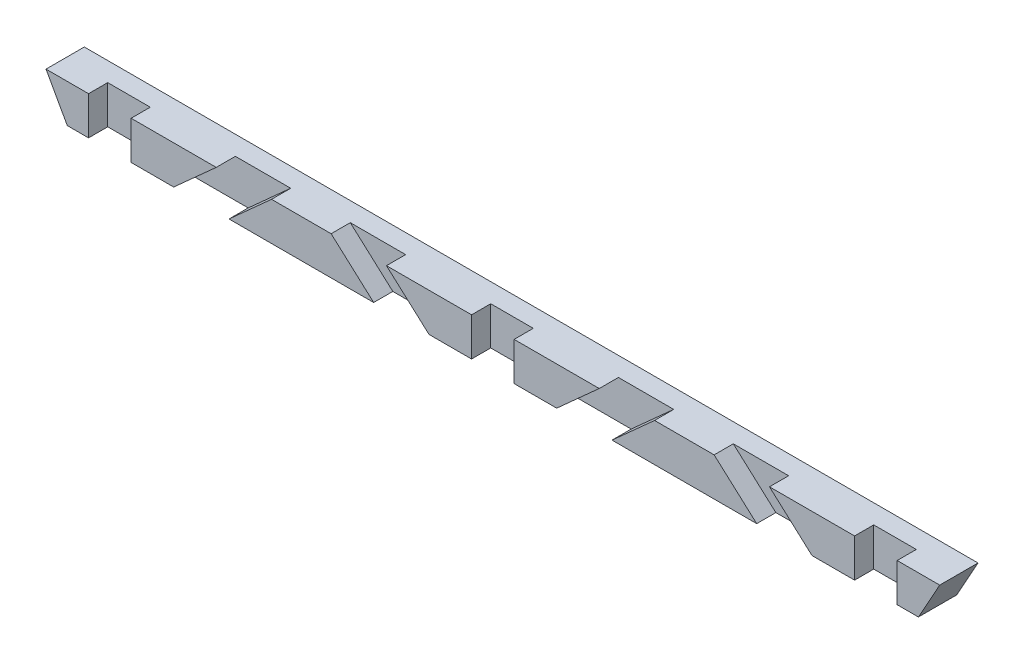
SolidWorks part; units mm, degrees
ref_plane "Plan de face" through (0, 0, 0) normal (0, 0, 1) x (1, 0, 0)
ref_plane "Plan de dessus" through (0, 0, 0) normal (0, 1, 0) x (1, 0, 0)
ref_plane "Plan de droite" through (0, 0, 0) normal (1, 0, 0) x (0, 0, -1)
sketch "Esquisse1" plane through (0, 0, 0) normal (0, 0, 1) x (1, 0, 0)
  line L1 (0, 0) -> (210, 0)
  line L2 (0, 0) -> (0, 9)
  line L3 (0, 9) -> (210, 9)
  line L4 (210, 0) -> (210, 9)
  dimension "D1" = 9
  dimension "D2" = 210
extrude "Extrusion2" add sketch "Esquisse1" along normal blind 9
sketch "Esquisse5" plane through (0, 0, 9) normal (0, 0, 1) x (1, 0, 0)
  line L0 (210, 0) -> (210, 9)
  line L1 (210, 9) -> (205, 0)
  line L2 (0, 0) -> (210, 0) construction
  line L3 (205, 0) -> (210, 0)
  line L4 (0, 0) -> (5, 0)
  line L5 (5, 0) -> (0, 9)
  line L6 (0, 9) -> (0, 0)
  dimension "D1" = 5
  dimension "D2" = 5
extrude "Enlèv. mat.-Extru.5" cut sketch "Esquisse5" against normal blind 9
sketch "Esquisse6" plane through (0, 0, 9) normal (0, 0, 1) x (1, 0, 0)
  line L0 (5, 0) -> (205, 0) construction
  line L1 (10, 0) -> (20, 0)
  line L2 (10, 0) -> (10, 9)
  line L3 (10, 9) -> (20, 9)
  line L4 (20, 0) -> (20, 9)
  line L5 (210, 9) -> (0, 9) construction
  line L7 (100, 0) -> (110, 0)
  line L8 (100, 0) -> (100, 9)
  line L9 (100, 9) -> (110, 9)
  line L10 (110, 0) -> (110, 9)
  line L11 (190, 0) -> (200, 0)
  line L12 (190, 0) -> (190, 9)
  line L13 (190, 9) -> (200, 9)
  line L14 (200, 0) -> (200, 9)
  dimension "D1" = 10
  dimension "D2" = 10
  dimension "D3" = 10
  dimension "D4" = 10
  dimension "D5" = 10
  dimension "D6" = 100
extrude "Enlèv. mat.-Extru.7" cut sketch "Esquisse6" against normal blind 4.5
sketch "Esquisse7" plane through (0, 0, 9) normal (0, 0, 1) x (1, 0, 0)
  line L0 (40, 9) -> (53, 9)
  line L1 (100, 9) -> (20, 9) construction
  line L2 (53, 9) -> (43, 0)
  line L3 (20, 0) -> (100, 0) construction
  line L4 (43, 0) -> (30, 0)
  line L5 (30, 0) -> (40, 9)
  line L6 (67, 9) -> (80, 9)
  line L7 (80, 9) -> (90, 0)
  line L8 (90, 0) -> (77, 0)
  line L9 (77, 0) -> (67, 9)
  line L10 (130, 9) -> (120, 0)
  line L11 (190, 9) -> (110, 9) construction
  line L12 (110, 0) -> (190, 0) construction
  line L13 (120, 0) -> (133, 0)
  line L14 (133, 0) -> (143, 9)
  line L15 (143, 9) -> (130, 9)
  line L16 (170, 9) -> (157, 9)
  line L17 (157, 9) -> (167, 0)
  line L18 (167, 0) -> (180, 0)
  line L19 (180, 0) -> (170, 9)
  dimension "D1" = 20
  dimension "D2" = 10
  dimension "D3" = 13
  dimension "D4" = 13
  dimension "D5" = 20
  dimension "D6" = 13
  dimension "D7" = 10
  dimension "D8" = 13
  dimension "D9" = 10
  dimension "D10" = 13
  dimension "D11" = 20
  dimension "D12" = 10
  dimension "D13" = 20
  dimension "D14" = 13
  dimension "D15" = 13
extrude "Enlèv. mat.-Extru.8" cut sketch "Esquisse7" against normal blind 4.5
